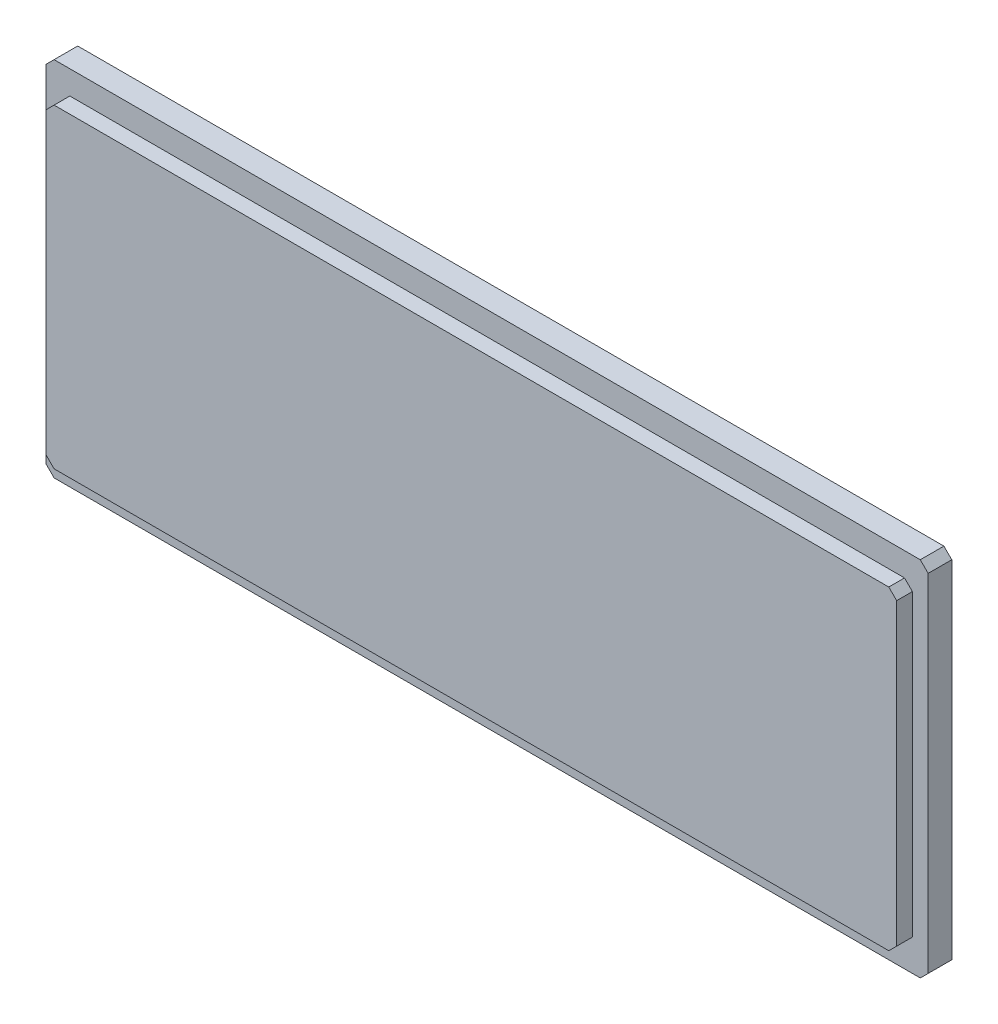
SolidWorks part; units mm, degrees
ref_plane "Plan1" through (0, 0, 0) normal (0, 0, 1) x (1, 0, 0)
ref_plane "Plan2" through (0, 0, 0) normal (0, 1, 0) x (1, 0, 0)
ref_plane "Plan3" through (0, 0, 0) normal (1, 0, 0) x (0, 0, -1)
sketch "Esquisse1" plane through (0, 0, 0) normal (0, 0, 1) x (1, 0, 0)
  line L1 (-41, 40) -> (15, 40)
  line L2 (-41, 40) -> (-41, 17)
  line L3 (-41, 17) -> (15, 17)
  line L4 (15, 40) -> (15, 17)
  dimension "D1" = 56
  dimension "D2" = 23
extrude "Base-Extrusion" add sketch "Esquisse1" along normal blind 1.5
sketch "Esquisse2" plane through (0, 0, 1.5) normal (0, 0, 1) x (1, 0, 0)
  line L0 (-41, 17) -> (15, 17) construction
  line L1 (-40, 38.5) -> (14, 38.5)
  line L2 (-40, 38.5) -> (-40, 18.5)
  line L3 (-40, 18.5) -> (14, 18.5)
  line L4 (14, 38.5) -> (14, 18.5)
  line L5 (-41, 40) -> (-41, 17) construction
  dimension "D1" = 20
  dimension "D2" = 1.5
  dimension "D3" = 20
  dimension "D4" = 1
  dimension "D5" = 54
extrude "Boss.-Extru.1" add sketch "Esquisse2" along normal blind 1
chamfer "Chanfrein1" distance 0.5 angle 45
chamfer "Chanfrein2" distance 0.5 angle 45
chamfer "Chanfrein3" distance 0.5 angle 45
chamfer "Chanfrein4" distance 0.5 angle 45
chamfer "Chanfrein5" distance 0.5 angle 45
chamfer "Chanfrein6" distance 0.5 angle 45
chamfer "Chanfrein7" distance 0.5 angle 45
chamfer "Chanfrein8" distance 0.5 angle 45
